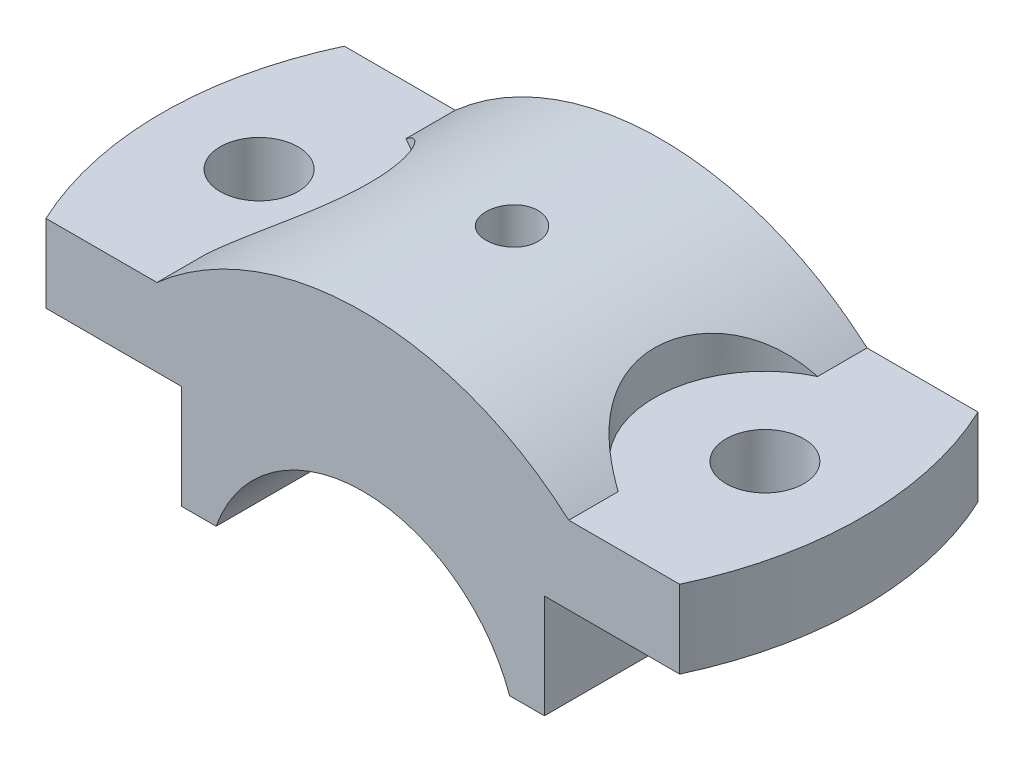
SolidWorks part; units mm, degrees
ref_plane "Front" through (0, 0, 0) normal (0, 0, 1) x (1, 0, 0)
ref_plane "Top" through (0, 0, 0) normal (0, 1, 0) x (1, 0, 0)
ref_plane "Right" through (0, 0, 0) normal (1, 0, 0) x (0, 0, -1)
sketch "Sketch1" plane through (0, 0, 0) normal (0, 0, 1) x (1, 0, 0)
  line L0 (-22.6274, 8) -> (-28, 8)
  line L1 (-28, 8) -> (-28, 24)
  line L2 (-28, 24) -> (-54, 24)
  line L3 (-54, 24) -> (-54, 36)
  line L4 (-54, 36) -> (-31.749, 36)
  line L5 (0, 77.2371) -> (0, 0) construction
  line L6 (54, 36) -> (31.749, 36)
  line L7 (54, 24) -> (54, 36)
  line L8 (28, 24) -> (54, 24)
  line L9 (28, 8) -> (28, 24)
  line L10 (22.6274, 8) -> (28, 8)
  arc A0 (22.6274, 8) -> (-22.6274, 8) centre (0, 0) ccw
  arc A1 (-31.749, 36) -> (31.749, 36) centre (0, 0) cw
  dimension "D1" = 48
  dimension "D5" = 48
  dimension "D2" = 8
  dimension "D3" = 16
  dimension "D4" = 12
  dimension "D6" = 108
  dimension "D7" = 56
extrude "Extrude1" add sketch "Sketch1" along normal mid plane 46
sketch "Sketch2" plane through (0, 36, 0) normal (0, 1, 0) x (-1, 0, 0)
  line L1 (-54, -23) -> (-31.749, -23) construction
  line L2 (-54, 23) -> (-31.749, 23) construction
  line L3 (0, 28.1928) -> (0, -32.8514) construction
  line L4 (-48.8569, 23) -> (48.8569, 23)
  line L5 (-48.8569, -23) -> (48.8569, -23)
  arc A0 (-48.8569, 23) -> (-48.8569, -23) centre (0, 0) ccw
  arc A1 (48.8569, 23) -> (48.8569, -23) centre (0, 0) cw
  dimension "D1" = 54
extrude "Cut-Extrude1" cut sketch "Sketch2" against normal through all flip side to cut
sketch "Sketch3" plane through (0, 36, 0) normal (0, 1, 0) x (-1, 0, 0)
  line L0 (-31.749, 23) -> (-31.749, -23) construction
  line L1 (-31.749, 15.3761) -> (-31.749, -15.3761)
  arc A0 (-31.749, -15.3761) -> (-31.749, 15.3761) centre (-39, 0) ccw
  dimension "D2" = 17
  dimension "D1" = 39
extrude "Cut-Extrude2" cut sketch "Sketch3" along normal through all
sketch "Sketch4" plane through (0, 36, 0) normal (0, 1, 0) x (-1, 0, 0)
  point P0 (-39, 0)
  dimension "D1" = 39
other "Hole1"
sketch "Sketch5" plane through (0, 36, 0) normal (0, 1, 0) x (-1, 0, 0)
  circle A0 centre (-39, 0) radius 6
  dimension "D1" = 12
mirror "Mirror1" about plane through (0, 0, 0) normal (1, 0, 0) of "Hole1", "Cut-Extrude2"
sketch "Sketch6" plane through (0, 0, 0) normal (0, 0, 1) x (1, 0, 0)
  line L0 (0, 0) -> (0, 51.2552) construction
  line L1 (0, 48) -> (4, 48)
  line L2 (4, 48) -> (4, 32)
  line L3 (4, 32) -> (3, 32)
  line L4 (3, 32) -> (3, 23.3974)
  line L5 (3, 23.3974) -> (0, 23.3974)
  line L6 (0, 23.3974) -> (0, 48)
  arc A0 (31.749, 36) -> (-31.749, 36) centre (0, 0) ccw construction
  dimension "D1" = 8
  dimension "D2" = 16
  dimension "D3" = 6
revolve "Cut-Revolve1" cut sketch "Sketch6" angle 360 about L0
